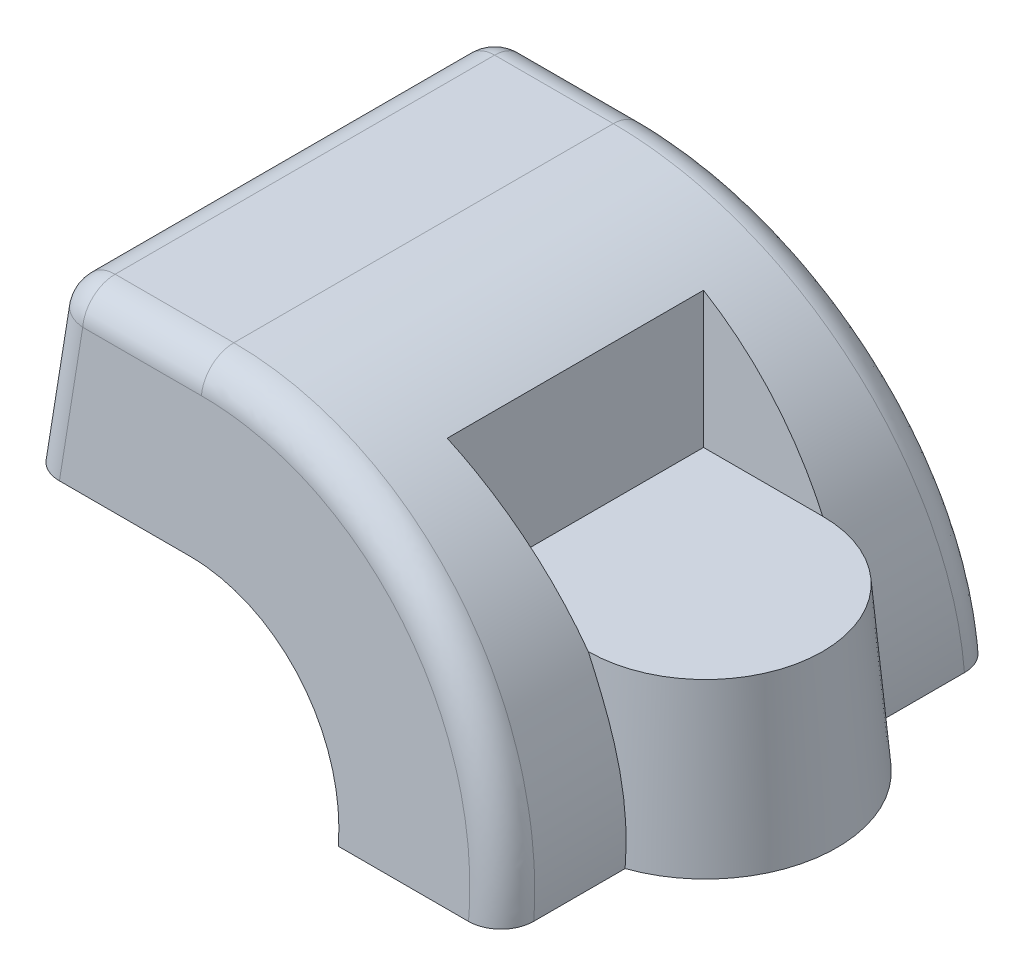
SolidWorks part; units mm, degrees
ref_plane "Front Plane" through (0, 0, 0) normal (0, 0, 1) x (1, 0, 0)
ref_plane "Top Plane" through (0, 0, 0) normal (0, 1, 0) x (1, 0, 0)
ref_plane "Right Plane" through (0, 0, 0) normal (1, 0, 0) x (0, 0, -1)
sketch "Sketch1" plane through (0, 0, 0) normal (0, 0, 1) x (1, 0, 0)
  line L0 (-25, 25) -> (0, 25)
  line L1 (25, 0) -> (50, 0)
  line L2 (0, 50) -> (-25, 50)
  line L3 (-25, 50) -> (-25, 25)
  arc A0 (0, 25) -> (25, 0) centre (0, 0) cw
  arc A1 (50, 0) -> (0, 50) centre (0, 0) ccw
  dimension "D1" = 25
  dimension "D2" = 50
  dimension "D3" = 25
extrude "Extrude1" add sketch "Sketch1" along normal mid plane 76.2
draft "Draft1" type of draft neutral plane draft angle 5 neutral plane "Top Plane" faces to draft 2 parameters "D1"=5
draft "Draft2" type of draft neutral plane draft angle 5 faces to draft 1 parameters "D1"=5
fillet "Fillet1" radius 5 7 edges at (-11.4064, 50, -33.7256) (-11.4064, 50, 33.7256) (-23.9064, 37.5, -34.8192) (-23.9064, 37.5, 34.8192) (-22.8128, 50, 0) (35.3553, 35.3553, -35.0068) (35.3553, 35.3553, 35.0068)
sketch "Sketch2" plane through (0, 25, 0) normal (0, -1, 0) x (1, 0, 0)
  line L0 (0, 0) -> (59.5, 0) construction
  line L1 (25, 18) -> (59.5, 18)
  line L2 (25, 18) -> (25, -18)
  line L3 (25, -18) -> (59.5, -18)
  line L4 (59.5, 18) -> (59.5, -18)
  line L5 (50, 33.0809) -> (50, -33.0809) construction
  line L6 (25, 38.1) -> (25, -38.1) construction
  dimension "D1" = 36
  dimension "D2" = 9.5
extrude "Pocket" cut sketch "Sketch2" against normal through all draft 5
sketch "Sketch3" plane through (0, 25, 0) normal (0, 1, 0) x (1, 0, 0)
  line L0 (25, 18) -> (43.3013, 18) construction
  line L1 (43.3013, 18) -> (43.3013, -18)
  arc A0 (43.3013, 18) -> (43.3013, -18) centre (43.3013, 0) cw
extrude "Boss" add sketch "Sketch3" against normal through all draft 5
